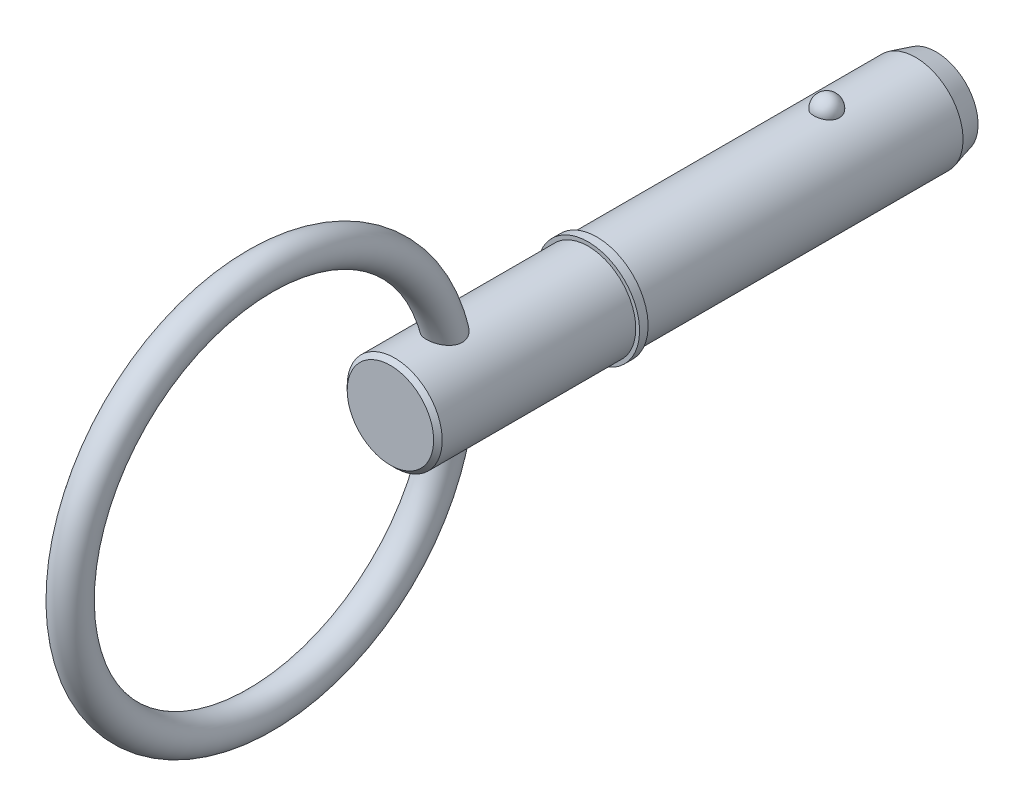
SolidWorks part; units mm, degrees
ref_plane "Front Plane" through (0, 0, 0) normal (0, 0, 1) x (1, 0, 0)
ref_plane "Top Plane" through (0, 0, 0) normal (0, 1, 0) x (1, 0, 0)
ref_plane "Right Plane" through (0, 0, 0) normal (1, 0, 0) x (0, 0, -1)
sketch "Sketch2" plane through (0, 0, 0) normal (0, 0, 1) x (1, 0, 0)
  circle A0 centre (0, 0) radius 5.555
  point P3 (0, 5.555)
  dimension "D1" = 11.11
extrude "Boss-Extrude1" add sketch "Sketch2" along normal blind 25.4
sketch "Sketch3" plane through (0, 0, 0) normal (0, 0, -1) x (-1, 0, 0)
  circle A0 centre (0, 0) radius 5.555
  dimension "D1" = 11.11
extrude "Boss-Extrude2" add sketch "Sketch3" along normal blind 14.27
chamfer "Chamfer1" distance 2.4 angle 15 1 edges at (-5.555, 0, -14.27)
sketch "Sketch18" plane through (0, 0, 0) normal (1, 0, 0) x (0, 0, -1)
  line L0 (11.87, 5.555) -> (-25.4, 5.555) construction
  line L1 (1.49, 7.045) -> (1.49, 4.065)
  line L2 (-25.4, -5.555) -> (11.87, -5.555) construction
  arc A0 (1.49, 7.045) -> (1.49, 4.065) centre (1.49, 5.555) ccw
  point P4 (0, 5.555)
  dimension "D1" = 12.6
revolve "Revolve1" add sketch "Sketch18" angle 360 about L1
sketch "Sketch19" plane through (0, 0, 0) normal (1, 0, 0) x (0, 0, -1)
  line L0 (-33.7288, 0) -> (-46.4542, 0) construction
sketch "Sketch20" plane through (0, 0, 0) normal (1, 0, 0) x (0, 0, -1)
  line L0 (-25.4, 0) -> (-25.4, 6)
  line L1 (-25.4, 5.555) -> (-25.4, -5.555) construction
  line L2 (-25.4, 6) -> (-26.4, 6)
  line L3 (-26.4, 6) -> (-26.4, 0)
  line L4 (-33.7288, 0) -> (-46.4542, 0) construction
  line L5 (-26.4, 0) -> (-25.4, 0)
  dimension "D1" = 6
  dimension "D2" = 1
revolve "Revolve2" add sketch "Sketch20" angle 360 about L0
sketch "Sketch21" plane through (0, 0, 25.4) normal (0, 0, -1) x (-1, 0, 0)
  circle A0 centre (0, 0) radius 5.555
  dimension "D1" = 11.11
extrude "Boss-Extrude3" add sketch "Sketch21" against normal blind 24.13
chamfer "Chamfer2" distance 0.5 angle 45 1 edges at (-5.555, 0, 49.53)
sketch "Sketch23" plane through (0, 0, 0) normal (1, 0, 0) x (0, 0, -1)
  line L0 (-49.53, 5.055) -> (-49.53, -5.055) construction
  circle A0 centre (-64.755, 0) radius 22.225
  point P2 (-42.53, 0)
  dimension "D1" = 44.45
  dimension "D2" = 7
sketch "Sketch24" plane through (0, 0, 0) normal (0, 1, 0) x (1, 0, 0)
  circle A0 centre (0, -42.53) radius 2
  dimension "D1" = 4
sweep "Sweep1" add profiles "Sketch24" path "Sketch23"
